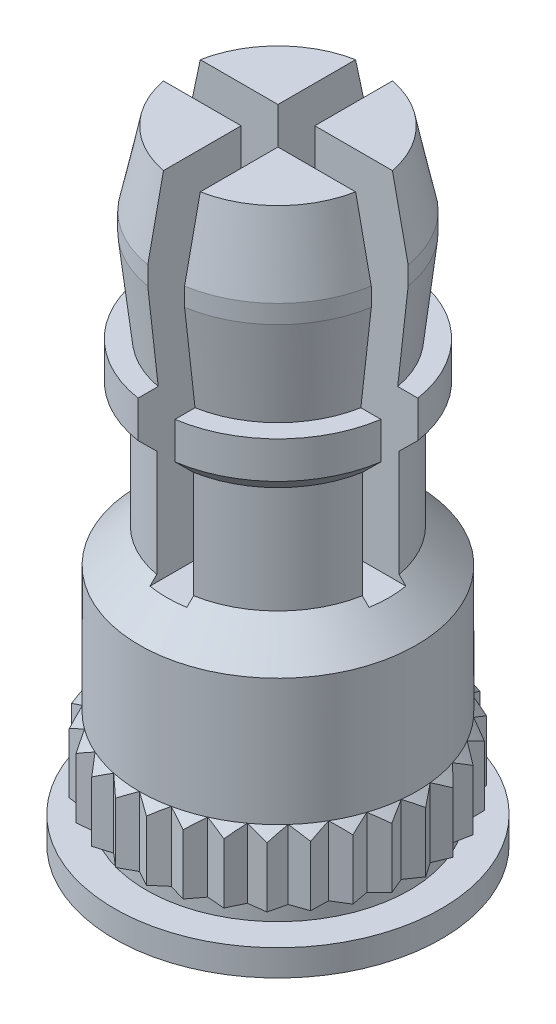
SolidWorks part; units mm, degrees
revolve "Body" add sketch "BodySke" angle 360 about L9
sketch "BodySke" plane through (0, 0, 0) normal (0, 0, 1) x (1, 0, 0)
  line L0 (2.5555, 0) -> (2.5555, 0.3825)
  line L1 (2.69, 4.1891) -> (2.0272, 4.8518)
  line L2 (2.87, 1.5475) -> (2.69, 1.7275)
  line L3 (2.0272, 4.8518) -> (2.0272, 6.9267)
  line L4 (0, -0.51) -> (3.175, -0.51)
  line L5 (3.175, -0.51) -> (3.175, 0)
  line L6 (3.175, 0) -> (2.5555, 0)
  line L7 (2.385, 7.2845) -> (2.385, 8)
  line L8 (2.69, 1.7275) -> (2.69, 4.1891)
  line L9 (0, -0.51) -> (0, 17.145) construction
  line L10 (2.385, 8) -> (2, 8)
  line L11 (2, 8) -> (2.2, 9.79)
  line L12 (2.2, 9.79) -> (2.2, 10.148)
  line L13 (2.2, 10.148) -> (1.9, 11.58)
  line L14 (1.9, 11.58) -> (0, 11.58)
  line L15 (2.5555, 0.3825) -> (2.87, 0.3825)
  line L16 (2.87, 0.3825) -> (2.87, 1.5475)
  line L17 (0, 11.58) -> (0, -0.51)
  line L19 (2.385, 7.2845) -> (2.0272, 6.9267)
ref_plane "Plane1" through (0, 0, 0) normal (0, 0, 1) x (1, 0, 0)
ref_plane "Plane2" through (0, 0, 0) normal (0, 1, 0) x (1, 0, 0)
ref_plane "Plane3" through (0, 0, 0) normal (1, 0, 0) x (0, 0, -1)
other "Configuration Table"
sketch "SlitCutSke" plane through (0, 11.58, 0) normal (0, 1, 0) x (-1, 0, 0)
  line L0 (-2.6661, 0.3578) -> (2.6661, 0.3578)
  line L1 (2.6661, -0.3578) -> (-2.6661, -0.3578)
  line L2 (-2.6661, 0.3578) -> (-2.6661, -0.3578)
  line L3 (2.6661, 0.3578) -> (2.6661, -0.3578)
  line L4 (-4.064, 0) -> (4.064, 0) construction
  circle A1 centre (0, 0) radius 2.69 construction
extrude "SlitCut" cut sketch "SlitCutSke" against normal blind 6.8582
pattern_circular "SlitCutPat" count 2 every 90 about axis through (0, -0.51, 0) along (0, 1, 0) of "SlitCut"
ref_plane "Plane4" through (0, -0.5486, 0) normal (0, 1, 0) x (-1, 0, 0)
sketch "CliRinCutSke" plane through (0, 0.3825, 0) normal (0, -1, 0) x (1, 0, 0)
  line L0 (0.3, 2.8543) -> (0, 2.69)
  line L1 (0, 2.69) -> (-0.3, 2.8543)
  line L2 (0, 0) -> (0, 5.842) construction
  arc A1 (0.3, 2.8543) -> (-0.3, 2.8543) centre (0, 0) ccw
  circle A2 centre (0, 0) radius 2.69 construction
extrude "ClinchCut" cut sketch "CliRinCutSke" against normal blind 1.345
pattern_circular "ClinchCutPat" count 30 every 12 about axis through (0, -0.51, 0) along (0, 1, 0) of "ClinchCut"
equation "' \"Panel_dia@BodySke\" = 4"
equation "' \"Length@BodySke\" = 8"
equation "' \"B_dia@BodySke\" = 4.77"
equation "' \"C_dia@BodySke\" = 5.38"
equation "' \"D_ht@BodySke\" = 3.58"
equation "' \"H_dia@BodySke\" = 6.35"
equation "' \"T_ht@BodySke\" = 0.51"
equation "' \"Clinch_dia@BodySke\" = 5.74"
equation "\"Tip_dia@BodySke\" = \"Panel_dia@BodySke\" * 0.95"
equation "\"Slip_dia@BodySke\" = \"Panel_dia@BodySke\" * 1.1"
equation "\"Slip_ht@BodySke\" = \"D_ht@BodySke\" * 0.1"
equation "\"Grip_ht@BodySke\" = \"D_ht@BodySke\" * 0.5"
equation "\"B_ht@BodySke\" = \"B_dia@BodySke\" * 0.15"
equation "\"Neck_dia@BodySke\" = \"B_dia@BodySke\" * 0.85"
equation "\"Neck_len@BodySke\" = \"B_dia@BodySke\" * 0.66"
equation "\"Groove_dia@BodySke\" = \"C_dia@BodySke\" * 0.95"
equation "\"Groove_wid@BodySke\" = \"T_ht@BodySke\" * 0.75"
equation "\"Width@SlitCutSke\" = \"B_ht@BodySke\""
equation "\"Depth@SlitCut\" = \"D_ht@BodySke\" + \"Neck_len@BodySke\" + 0.13"
equation "\"Clinch_lim@BodySke\" = \"C_dia@BodySke\" * 0.25"
equation "\"Count@ClinchCutPat\" = 30"
equation "\"Angle@ClinchCutPat\" = 360 / \"Count@ClinchCutPat\""
equation "\"Angle@CliRinCutSke\" = 360 / \"Count@ClinchCutPat\""
equation "\"Clinch_dia@CliRinCutSke\" = \"Clinch_dia@BodySke\""
equation "\"Clinch_minor@CliRinCutSke\" = \"C_dia@BodySke\""
equation "\"Depth@ClinchCut\" = \"Clinch_lim@BodySke\""
